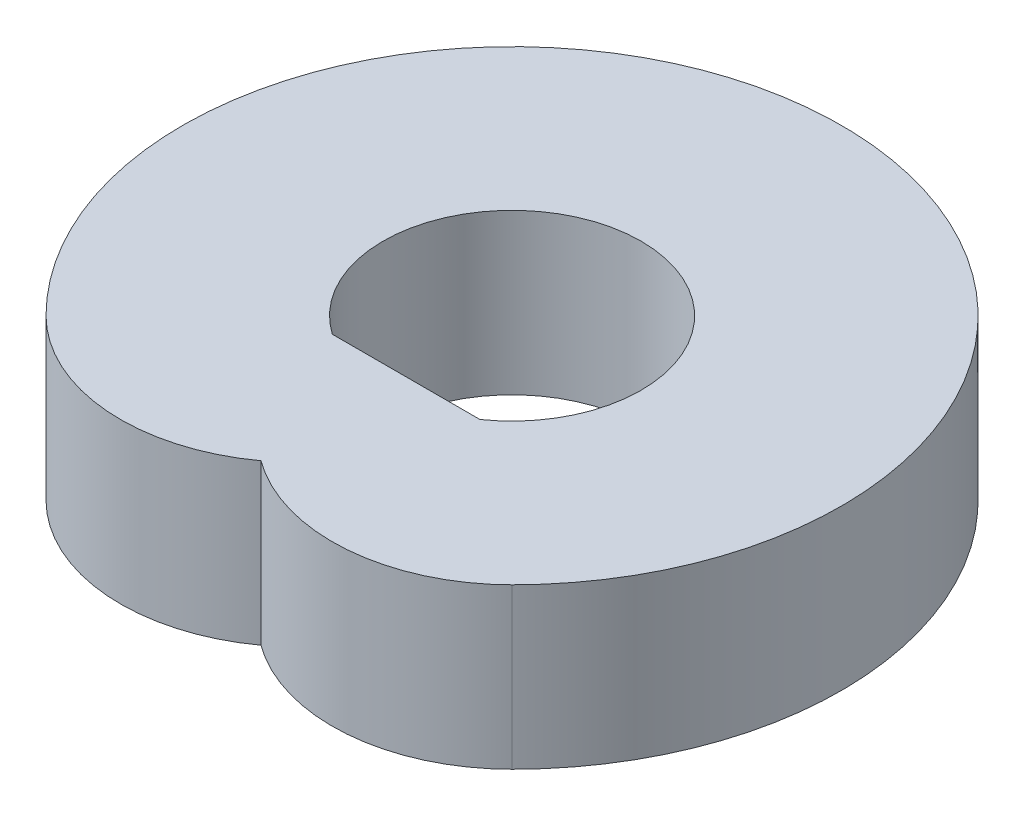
SolidWorks part; units mm, degrees
ref_plane "前视基准面" through (0, 0, 0) normal (0, 0, 1) x (1, 0, 0)
ref_plane "上视基准面" through (0, 0, 0) normal (0, 1, 0) x (1, 0, 0)
ref_plane "右视基准面" through (0, 0, 0) normal (1, 0, 0) x (0, 0, -1)
sketch "草图1" plane through (0, 0, 0) normal (0, 1, 0) x (1, 0, 0)
  line L0 (0, 0) -> (0, 825) construction
  line L1 (0, 0) -> (-583.3631, -583.3631) construction
  line L2 (0, 0) -> (583.3631, -583.3631) construction
  line L3 (0, 375) -> (318.1981, 56.8019) construction
  line L4 (0, 375) -> (-318.1981, 56.8019) construction
  line L6 (184.835, -265.165) -> (-184.835, -265.165)
  circle A0 centre (0, 0) radius 375 construction
  circle A1 centre (0, 375) radius 450 construction
  arc A2 (583.3631, -583.3631) -> (-583.3631, -583.3631) centre (0, 0) ccw
  arc A4 (-583.3631, -583.3631) -> (0, -628.741) centre (-265.165, -265.165) ccw
  arc A5 (0, -628.741) -> (583.3631, -583.3631) centre (265.165, -265.165) ccw
  arc A7 (184.835, -265.165) -> (-184.835, -265.165) centre (0, 0) ccw
  dimension "D1" = 750
  dimension "D2" = 900
  dimension "D4" = 135
  dimension "D3" = 825
  dimension "D8" = 135
  dimension "D5" = 135
  dimension "D6" = 135
  dimension "D7" = 135
extrude "凸台-拉伸1" add sketch "草图1" along normal blind 400
